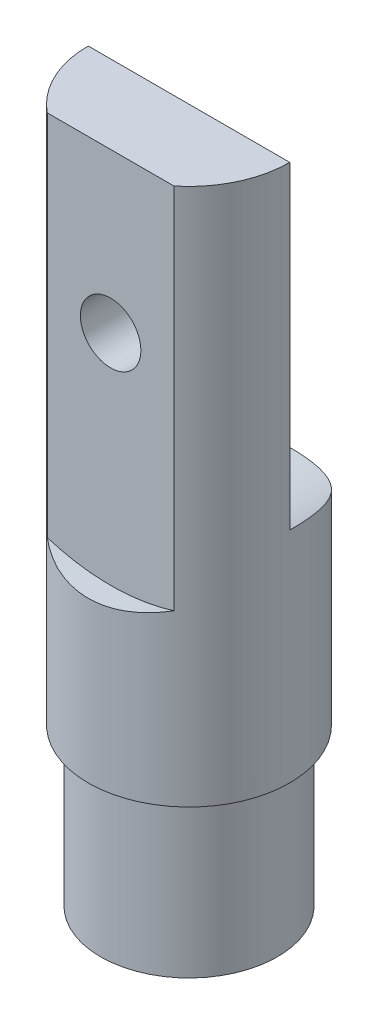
SolidWorks part; units mm, degrees
ref_plane "Front Plane" through (0, 0, 0) normal (0, 0, 1) x (1, 0, 0)
ref_plane "Top Plane" through (0, 0, 0) normal (0, 1, 0) x (1, 0, 0)
ref_plane "Right Plane" through (0, 0, 0) normal (1, 0, 0) x (0, 0, -1)
sketch "Sketch1" plane through (0, 0, 0) normal (0, 1, 0) x (1, 0, 0)
  circle A0 centre (0, 0) radius 4.5
  dimension "D1" = 9
extrude "Boss-Extrude1" add sketch "Sketch1" along normal blind 24 contours A0
sketch "Sketch2" plane through (0, 0, 0) normal (0, -1, 0) x (1, 0, 0)
  circle A0 centre (0, 0) radius 3.9
  dimension "D1" = 7.8
extrude "Boss-Extrude2" add sketch "Sketch2" along normal blind 7
sketch "Sketch4" plane through (0, 0, 0) normal (0, -1, 0) x (1, 0, 0)
  line L0 (-4.6448, 3.9) -> (4.9302, 3.9)
  line L1 (4.9302, 3.9) -> (4.9302, 6.135)
  line L2 (4.9302, 6.135) -> (-4.5584, 6.135)
  line L3 (-4.5584, 6.135) -> (-4.6448, 3.9)
  line L4 (-5.2639, -3.9) -> (5.6645, -3.9)
  line L5 (5.6645, -3.9) -> (5.6645, -4.8677)
  line L6 (5.6645, -4.8677) -> (-5.2639, -4.767)
  line L7 (-5.2639, -4.767) -> (-5.2639, -3.7879)
  circle A0 centre (0, 0) radius 3.9 construction
extrude "Cut-Extrude3" [suppressed] cut sketch "Sketch4" against normal blind 22 contours L2 L3 L0 L1 M2 | L7 L6 L5 L4 M2 | L4 M2
sketch "Sketch5" [suppressed] plane through (0, 0, 0) normal (1, 0, 0) x (0, 0, -1)
  line L0 (3.9, 21.5) -> (-3.9, 21.5) construction
  line L1 (5.8488, 18.5) -> (0.1, 18.5)
  line L2 (5.8488, 18.5) -> (5.8488, 14.5)
  line L3 (5.8488, 14.5) -> (0.1, 14.5)
  line L4 (0.1, 18.5) -> (0.1, 14.5)
  line L5 (-3.9, 21.5) -> (-3.9, 0) construction
  dimension "D1" = 3
  dimension "D2" = 4
  dimension "D3" = 4
extrude "Cut-Extrude4" [suppressed] cut sketch "Sketch5" against normal through all both and the other way through all
sketch "Sketch6" plane through (0, -7, 0) normal (0, -1, 0) x (1, 0, 0)
  circle A0 centre (0, 0) radius 3.95
  dimension "D1" = 7.9
sketch "Sketch7" plane through (0, -7, 0) normal (0, -1, 0) x (1, 0, 0)
  circle A0 centre (0, 0) radius 3.9
extrude "Cut-Extrude6" cut sketch "Sketch7" against normal blind 7
extrude "Boss-Extrude3" add sketch "Sketch6" against normal blind 7 contours A0
sketch "Sketch8" plane through (0, -7, 0) normal (0, -1, 0) x (1, 0, 0)
  line L1 (-3.2888, -2) -> (3.2888, -2)
  line L2 (-3.2888, -2) -> (-3.2888, 2)
  line L3 (-3.2888, 2) -> (3.2888, 2)
  line L4 (3.2888, -2) -> (3.2888, 2)
  line L5 (-3.2888, -2) -> (3.2888, 2) construction
  line L6 (-3.2888, 2) -> (3.2888, -2) construction
  line L7 (-3.5081, -2.9965) -> (3.5081, -2.9965)
  line L8 (-3.5081, -2.9965) -> (-3.5081, 2.9965)
  line L9 (-3.5081, 2.9965) -> (3.5081, 2.9965)
  line L10 (3.5081, -2.9965) -> (3.5081, 2.9965)
  line L11 (-3.5081, -2.9965) -> (3.5081, 2.9965) construction
  line L12 (-3.5081, 2.9965) -> (3.5081, -2.9965) construction
  point P0 (0, 0)
  point P6 (0, 0)
  dimension "D1" = 4
sketch "Sketch15" plane through (0, -7, 0) normal (0, -1, 0) x (1, 0, 0)
  circle A0 centre (0, 0) radius 2.5
  dimension "D1" = 5
extrude "Cut-Extrude18" cut sketch "Sketch15" against normal blind 9
sketch "Sketch9" [suppressed] plane through (0, 0, -3.9) normal (0, 0, -1) x (-1, 0, 0)
  line L0 (2.245, 0) -> (-2.245, 0) construction
  circle A0 centre (0, 19) radius 1.5
  dimension "D1" = 3
  dimension "D2" = 19
extrude "Cut-Extrude8" [suppressed] cut sketch "Sketch9" against normal blind 6
sketch "Sketch10" [suppressed] plane through (0, 0, -3.9) normal (0, 0, -1) x (-1, 0, 0)
  circle A0 centre (0, 19) radius 2
  dimension "D1" = 4
extrude "Cut-Extrude13" [suppressed] cut sketch "Sketch10" against normal blind 4
sketch "Sketch11" plane through (0, 24, 0) normal (0, 1, 0) x (1, 0, 0)
  line L0 (-4.5, 0) -> (4.5, 0)
  line L1 (-2.8284, -3.5) -> (2.8284, -3.5)
  arc A0 (4.5, 0) -> (-4.5, 0) centre (0, 0) ccw
  circle A1 centre (0, 0) radius 4.5
  arc A2 (-2.8284, -3.5) -> (2.8284, -3.5) centre (0, 0) ccw
  dimension "D2" = 3.5
  dimension "D1" = 0
extrude "Cut-Extrude14" cut sketch "Sketch11" against normal blind 8
chamfer "Chamfer1" [suppressed] distance 3 angle 55
sketch "Sketch12" plane through (0, 0, 0) normal (0, 0, -1) x (-1, 0, 0)
  circle A0 centre (0, 16.9016) radius 1.35
  dimension "D1" = 2.7
extrude "Cut-Extrude15" cut sketch "Sketch12" against normal through all
sketch "Sketch13" plane through (0, 0, 0) normal (0, 0, -1) x (-1, 0, 0)
  circle A0 centre (0, 16.9016) radius 8.426
extrude "Cut-Extrude16" cut sketch "Sketch13" along normal blind 8
sketch "Sketch14" plane through (0, 0, 3.5) normal (0, 0, 1) x (1, 0, 0)
  circle A0 centre (0, 16.5915) radius 9.4513
extrude "Cut-Extrude17" cut sketch "Sketch14" along normal blind 8
sketch "Sketch16" plane through (0, -7, 0) normal (0, -1, 0) x (1, 0, 0)
  line L1 (-2.5298, -2) -> (2.5298, -2)
  line L2 (-2.5298, -2) -> (-2.5298, 2)
  line L3 (-2.5298, 2) -> (2.5298, 2)
  line L4 (2.5298, -2) -> (2.5298, 2)
  line L5 (-2.5298, -2) -> (2.5298, 2) construction
  line L6 (-2.5298, 2) -> (2.5298, -2) construction
  line L7 (-2.8174, -2.7686) -> (2.8174, -2.7686)
  line L8 (-2.8174, -2.7686) -> (-2.8174, 2.7686)
  line L9 (-2.8174, 2.7686) -> (2.8174, 2.7686)
  line L10 (2.8174, -2.7686) -> (2.8174, 2.7686)
  line L11 (-2.8174, -2.7686) -> (2.8174, 2.7686) construction
  line L12 (-2.8174, 2.7686) -> (2.8174, -2.7686) construction
  circle A0 centre (0, 0) radius 3.95 construction
  point P0 (0, 0)
  point P6 (0, 0)
  dimension "D1" = 4
extrude "Boss-Extrude5" add sketch "Sketch16" against normal blind 11
